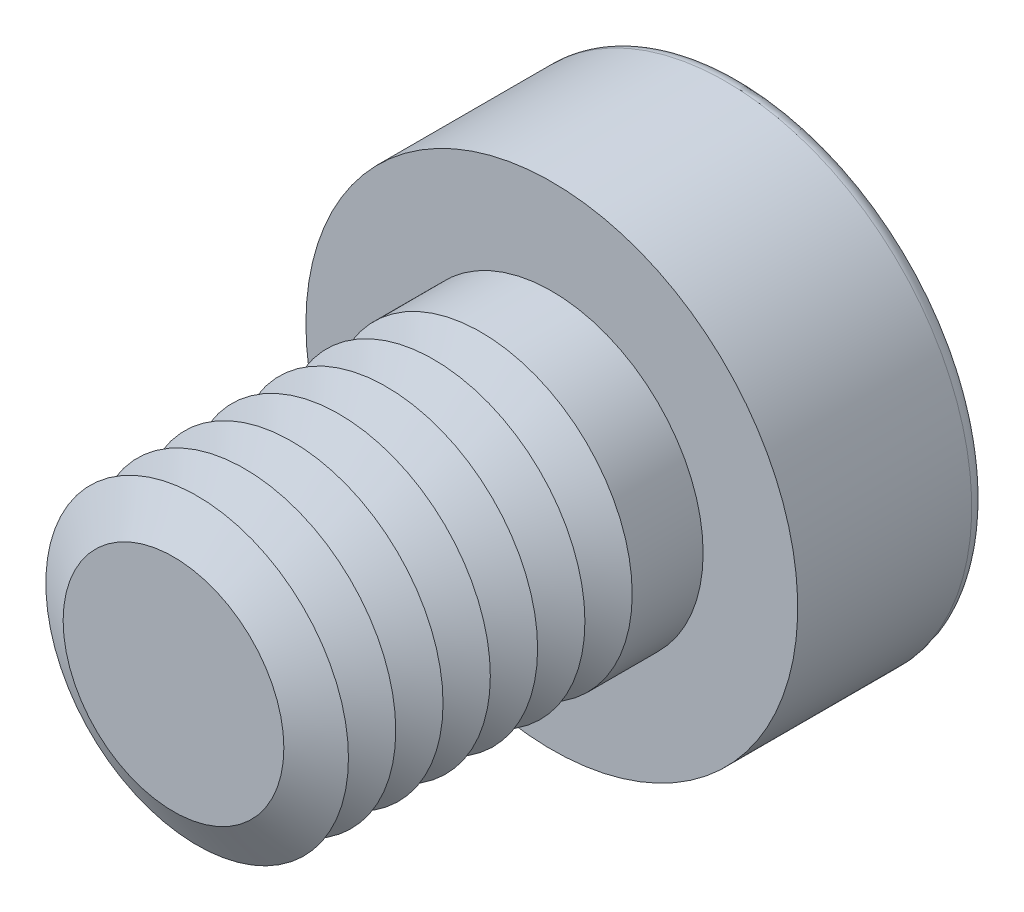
SolidWorks part; units mm, degrees
ref_plane "Front Plane" through (0, 0, 0) normal (0, 0, 1) x (1, 0, 0)
ref_plane "Top Plane" through (0, 0, 0) normal (0, 1, 0) x (1, 0, 0)
ref_plane "Right Plane" through (0, 0, 0) normal (1, 0, 0) x (0, 0, -1)
sketch "Sketch1" plane through (0, 0, 0) normal (0, 0, 1) x (1, 0, 0)
  circle A0 centre (0, 0) radius 4
  dimension "D1" = 8
extrude "Boss-Extrude1" add sketch "Sketch1" along normal blind 10
sketch "Sketch2" plane through (0, 0, 0) normal (0, 0, -1) x (-1, 0, 0)
  circle A0 centre (0, 0) radius 6.5
  dimension "D1" = 13
extrude "Boss-Extrude2" add sketch "Sketch2" along normal blind 5
sketch "Sketch3" plane through (0, 0, -5) normal (0, 0, -1) x (-1, 0, 0)
  line L1 (-1.4434, 2.5) -> (-2.8868, 0)
  line L2 (-2.8868, 0) -> (-1.4434, -2.5)
  line L3 (-1.4434, -2.5) -> (1.4434, -2.5)
  line L4 (1.4434, -2.5) -> (2.8868, 0)
  line L5 (2.8868, 0) -> (1.4434, 2.5)
  line L6 (1.4434, 2.5) -> (-1.4434, 2.5)
  circle A0 centre (0, 0) radius 2.5 construction
  dimension "D1" = 5
extrude "Cut-Extrude1" cut sketch "Sketch3" against normal blind 3.75
fillet "Fillet1" radius 0.4 1 edges at (-6.5, 0, -5)
sketch "Sketch4" plane through (0, 0, -1.25) normal (0, 0, -1) x (-1, 0, 0)
  line L0 (1.4434, -2.5) -> (2.8868, 0) construction
  circle A0 centre (0, 0) radius 2.5
extrude "Cut-Extrude2" cut sketch "Sketch4" against normal through all draft 60
sketch "Sketch5" plane through (0, 0, -5) normal (0, 0, -1) x (-1, 0, 0)
  circle A0 centre (0, 0) radius 2.8868
extrude "Cut-Extrude3" cut sketch "Sketch5" against normal through all draft 75
sketch "Sketch7" plane through (0, 0, 0) normal (1, 0, 0) x (0, 0, -1)
  line L25 (-10, 2.9175) -> (-9.375, 4)
  line L26 (-10, 4) -> (-10, -4) construction
  line L27 (-9.375, 4) -> (-10.625, 4)
  line L28 (-10.625, 4) -> (-10, 2.9175)
  line L29 (0, 4) -> (-10, 4) construction
  dimension "D1" = 1.25
revolve "Cut-Revolve1" cut sketch "Sketch7" angle 360 about axis through (0, 0, 10) along (0, 0, -1)
pattern_linear "LPattern1" count 7 spacing 1.25 along (0, 0, -1) of "Cut-Revolve1"
